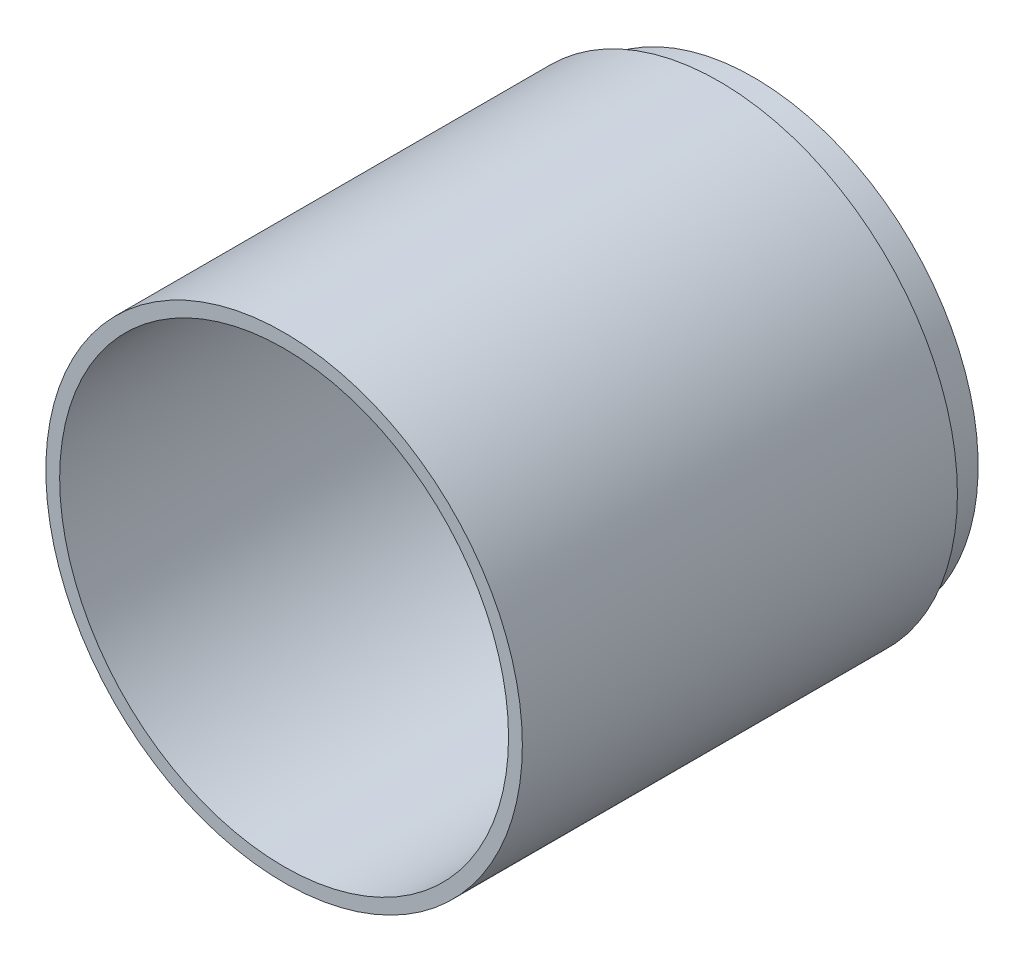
SolidWorks part; units mm, degrees
ref_plane "Plan de face" through (0, 0, 0) normal (0, 0, 1) x (1, 0, 0)
ref_plane "Plan de dessus" through (0, 0, 0) normal (0, 1, 0) x (1, 0, 0)
ref_plane "Plan de droite" through (0, 0, 0) normal (1, 0, 0) x (0, 0, -1)
sketch "Esquisse1" plane through (0, 0, 0) normal (0, 0, 1) x (1, 0, 0)
  circle A0 centre (0, 0) radius 34.5
  circle A1 centre (0, 0) radius 32.5
  dimension "D1" = 69
  dimension "D2" = 65
extrude "Boss.-Extru.1" add sketch "Esquisse1" along normal blind 63
sketch "Esquisse2" plane through (0, 0, 0) normal (0, 0, -1) x (-1, 0, 0)
  circle A0 centre (0, 0) radius 32.5
  circle A1 centre (0, 0) radius 30.5
  dimension "D1" = 65
  dimension "D2" = 61
extrude "Boss.-Extru.2" add sketch "Esquisse2" along normal blind 5 and the other way blind 3
